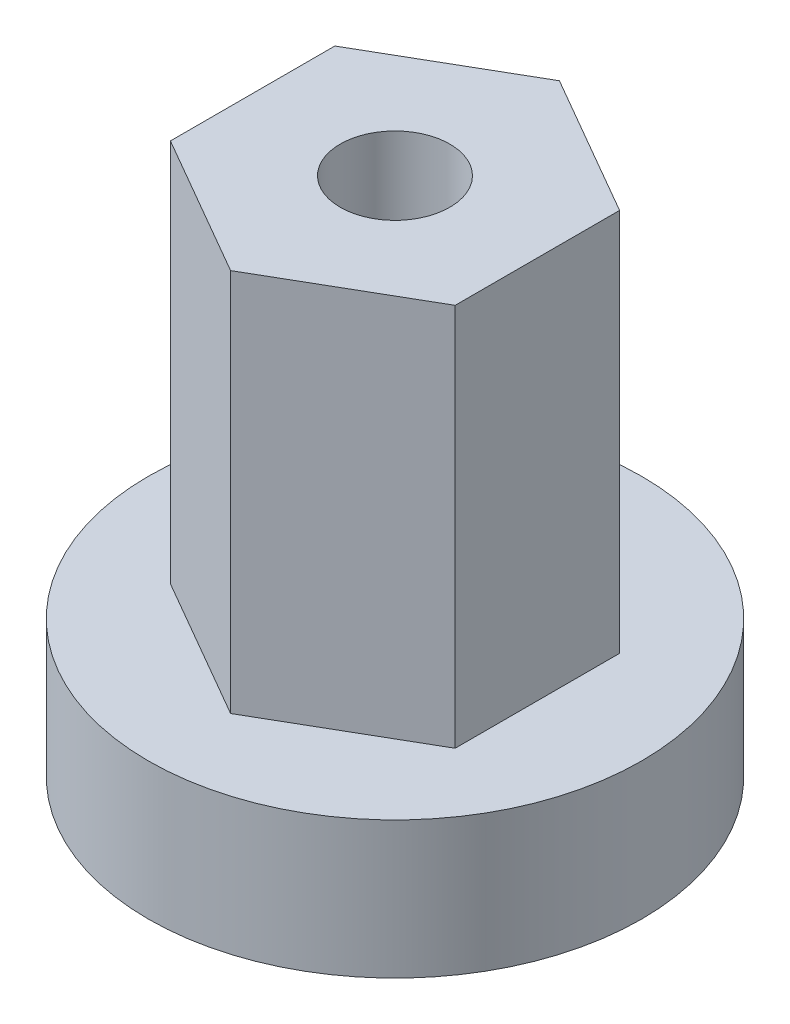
SolidWorks part; units mm, degrees
ref_plane "前视基准面" through (0, 0, 0) normal (0, 0, 1) x (1, 0, 0)
ref_plane "上视基准面" through (0, 0, 0) normal (0, 1, 0) x (1, 0, 0)
ref_plane "右视基准面" through (0, 0, 0) normal (1, 0, 0) x (0, 0, -1)
sketch "草图1" plane through (0, 0, 0) normal (0, 1, 0) x (1, 0, 0)
  circle A0 centre (0, 0) radius 18
  dimension "D1" = 36
extrude "凸台-拉伸1" add sketch "草图1" along normal blind 10
sketch "草图2" plane through (0, 10, 0) normal (0, 1, 0) x (1, 0, 0)
  line L1 (0, 12) -> (-10.3923, 6)
  line L2 (-10.3923, 6) -> (-10.3923, -6)
  line L3 (-10.3923, -6) -> (0, -12)
  line L4 (0, -12) -> (10.3923, -6)
  line L5 (10.3923, -6) -> (10.3923, 6)
  line L6 (10.3923, 6) -> (0, 12)
  circle A0 centre (0, 0) radius 12 construction
  dimension "D1" = 24
extrude "凸台-拉伸2" add sketch "草图2" along normal blind 28
sketch "草图3" plane through (0, 0, 0) normal (0, 0, 1) x (1, 0, 0)
  line L0 (0, 39.0106) -> (0, -2.9583) construction
  line L1 (0, 38) -> (-4, 38)
  line L2 (-10.3923, 38) -> (0, 38) construction
  line L3 (-4, 38) -> (-4, 22)
  line L4 (-4, 22) -> (-7, 22)
  line L5 (-7, 22) -> (-7, 0)
  line L6 (-18, 0) -> (18, 0) construction
  line L7 (-7, 0) -> (0, 0)
  line L8 (0, 0) -> (0, 38)
  dimension "D1" = 4
  dimension "D2" = 7
  dimension "D3" = 22
revolve "切除-旋转1" cut sketch "草图3" angle 360 about L0
